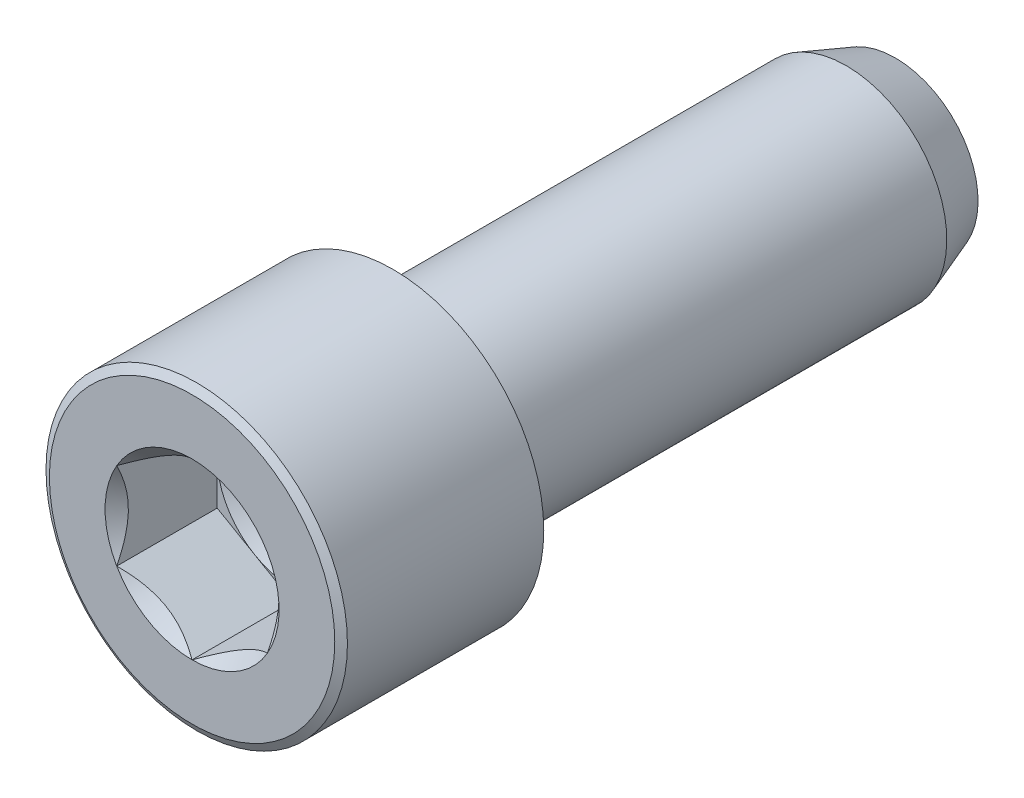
SolidWorks part; units mm, degrees
ref_plane "Front" through (0, 0, 0) normal (0, 0, 1) x (1, 0, 0)
ref_plane "Top" through (0, 0, 0) normal (0, 1, 0) x (1, 0, 0)
ref_plane "Right" through (0, 0, 0) normal (1, 0, 0) x (0, 0, -1)
sketch "Sketch1" plane through (0, 0, 0) normal (1, 0, 0) x (0, 0, -1)
  line L0 (0, 0) -> (-1.5875, 0) construction
  line L1 (0, 0) -> (15.875, 0)
  line L2 (0, 0) -> (0, 3.175)
  line L3 (0, 3.175) -> (15.875, 3.175)
  line L4 (15.875, 0) -> (15.875, 3.175)
  line L5 (0, -3.175) -> (15.875, -3.175) construction
revolve "Revolve1" add sketch "Sketch1" angle 360 about L0
sketch "Sketch2" plane through (0, 0, 0) normal (1, 0, 0) x (0, 0, -1)
  line L0 (0, 3.175) -> (0, -3.175) construction
  line L1 (0, -3.175) -> (1.27, -3.175) construction
  line L2 (1.27, -3.175) -> (0, 3.175) construction
  line L3 (0, 3.175) -> (0.1557, 3.2061) construction
  line L4 (0.1557, 3.2061) -> (1.2453, 3.4241)
  line L5 (1.2453, 3.4241) -> (0.991, 2.6722)
  line L6 (0.991, 2.6722) -> (0.6796, 2.6099)
  line L7 (0.6796, 2.6099) -> (0.1557, 3.2061)
  line L8 (0.8353, 2.641) -> (0.7005, 3.3151) construction
  line L9 (0, -3.175) -> (15.875, -3.175) construction
  line L10 (0, 3.175) -> (15.875, 3.175) construction
  line L12 (0.7285, 3.175) -> (1.9985, -3.175) construction
  line L13 (0, -0.2727) -> (2.727, 0.2727) construction
  line L15 (0, 0) -> (0, 3.175) construction
  point P19 (1.3635, 0)
revolve "Cut-Revolve1" [suppressed] cut sketch "Sketch2" angle 360 about L13
sketch "Sketch3" plane through (0, 0, 0) normal (1, 0, 0) x (0, 0, -1)
  line L0 (15.875, 2.6099) -> (14.3224, 3.175)
  line L1 (14.3224, 3.175) -> (15.875, 3.175)
  line L2 (15.875, 3.175) -> (15.875, 2.6099)
  line L3 (0, 3.175) -> (15.875, 3.175) construction
  line L4 (15.875, 0) -> (15.875, 3.175) construction
  line L5 (14.3224, 0) -> (0, 0) construction
  line L6 (14.3224, 3.175) -> (14.3224, -3.175) construction
  line L7 (0, -3.175) -> (15.875, -3.175) construction
  dimension "D1" = 20
  dimension "D2" = 6.35
revolve "Cut-Revolve2" cut sketch "Sketch3" angle 360 about L5
pattern_linear "LPattern1" [suppressed] count 13 spacing 1.27 along (0, 0, 1)
pattern_linear "LPattern2" [suppressed] count 2 spacing 1.27 along (0, 0, 1)
sketch "Sketch4" plane through (0, 0, 0) normal (0, 0, 1) x (1, 0, 0)
  circle A0 centre (0, 0) radius 4.7625
  dimension "Head Dia" = 9.525
extrude "Extrude1" add sketch "Sketch4" along normal blind 6.35
chamfer "Chamfer1" distance 0.254 angle 30 1 edges at (4.7625, 0, 6.35)
sketch "Sketch6" plane through (0, 0, 6.35) normal (0, 0, 1) x (1, 0, 0)
  line L1 (0, -2.7496) -> (2.3812, -1.3748)
  line L2 (2.3812, -1.3748) -> (2.3812, 1.3748)
  line L3 (2.3812, 1.3748) -> (0, 2.7496)
  line L4 (0, 2.7496) -> (-2.3813, 1.3748)
  line L5 (-2.3813, 1.3748) -> (-2.3813, -1.3748)
  line L6 (-2.3813, -1.3748) -> (0, -2.7496)
  circle A0 centre (0, 0) radius 2.3813 construction
  dimension "Hex" = 4.7625
extrude "Cut-Extrude1" cut sketch "Sketch6" against normal blind 3.175
sketch "Sketch7" plane through (0, 0, 6.35) normal (0, 0, 1) x (1, 0, 0)
  circle A0 centre (0, 0) radius 2.7496
extrude "Cut-Extrude4" cut sketch "Sketch7" against normal blind 3.175 draft 45
sketch "Sketch8" plane through (0, 0, 3.175) normal (0, 0, 1) x (1, 0, 0)
  circle A0 centre (0, 0) radius 2.3813 construction
  circle A1 centre (0, 0) radius 2.3813
extrude "Cut-Extrude5" cut sketch "Sketch8" against normal blind 1.0583 draft 60
equation "\"D1@Sketch1\"=\"Screw Length@Sketch1\"/10"
equation "\"D2@Sketch2\"=\"Thread Pitch@Sketch2\"/8"
equation "\"D3@Sketch2\"=\"Thread Pitch@Sketch2\"/4"
equation "\"D4@Sketch2\"=\"Thread Pitch@Sketch2\""
equation "\"D3@LPattern1\"=\"Thread Pitch@Sketch2\""
equation "\"D1@Chamfer1\"=\"Thread Dia@Sketch1\"/25"
equation "\"D1@Cut-Extrude1\"=\"Head Height@Extrude1\"/2"
equation "\"D1@Cut-Extrude4\"=\"D1@Cut-Extrude1\""
equation "\"D1@Cut-Extrude5\"=\"D1@Cut-Extrude1\"/3"
equation "\"D1@LPattern1\"=\"Screw Length@Sketch1\"/\"Thread Pitch@Sketch2\""
equation "\"D3@LPattern2\"=\"Thread Pitch@Sketch2\""
